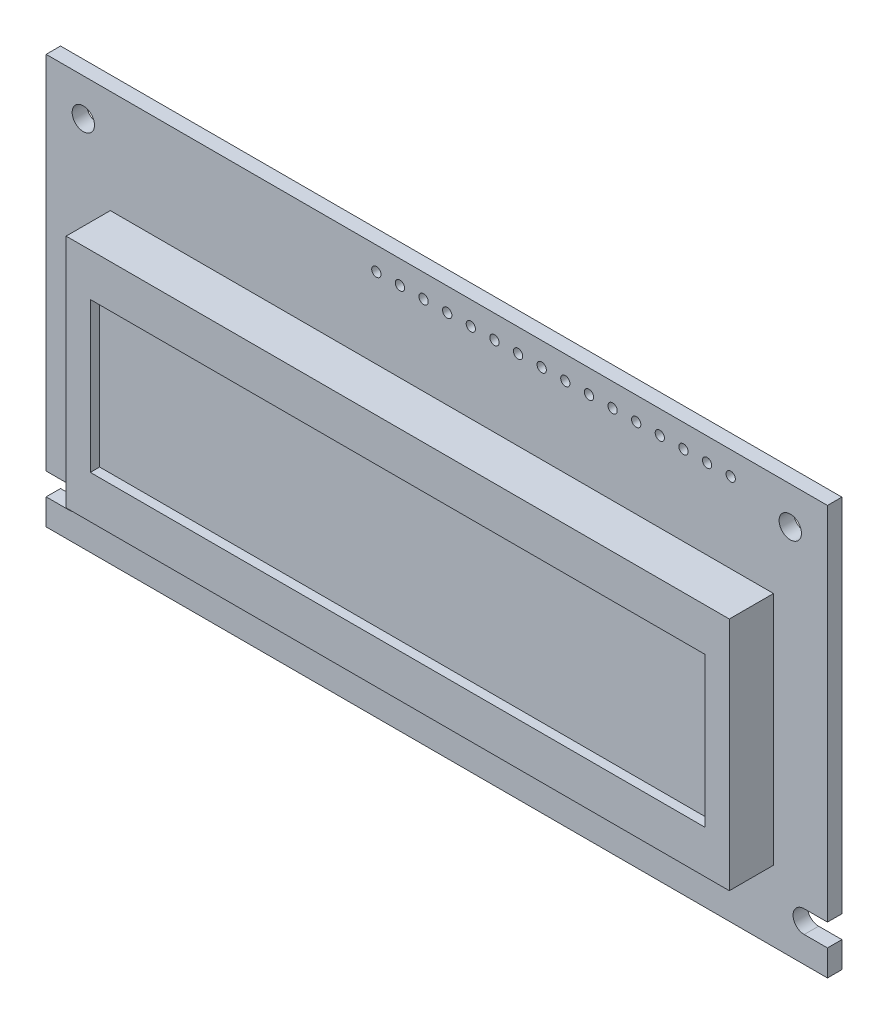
SolidWorks part; units mm, degrees
ref_plane "Plan de face" through (0, 0, 0) normal (0, 0, 1) x (1, 0, 0)
ref_plane "Plan de dessus" through (0, 0, 0) normal (0, 1, 0) x (1, 0, 0)
ref_plane "Plan de droite" through (0, 0, 0) normal (1, 0, 0) x (0, 0, -1)
sketch "Esquisse1" plane through (0, 0, 0) normal (0, 0, 1) x (1, 0, 0)
  line L0 (-56.4282, 29.4905) -> (26.4884, 29.4905) construction
  line L1 (-62.9008, 31.9905) -> (21.0992, 31.9905)
  line L2 (-62.9008, 31.9905) -> (-62.9008, -6.8095)
  line L3 (-62.9008, -12.0095) -> (21.0992, -12.0095)
  line L4 (21.0992, 31.9905) -> (21.0992, -6.8095)
  line L5 (-20.9008, 37.9919) -> (-20.9008, 31.9905) construction
  line L6 (-67.4282, 27.9905) -> (-57.0246, 27.9905) construction
  line L7 (-58.9008, 28.6835) -> (-58.9008, 9.2014) construction
  line L8 (-27.4008, 29.4905) -> (-27.4008, 41.6715) construction
  line L9 (-67.4282, -8.0095) -> (-56.4282, -8.0095) construction
  line L10 (-60.4008, -21.7605) -> (-60.4008, -4.1059) construction
  line L11 (-60.4008, -6.8095) -> (-62.9008, -6.8095)
  line L12 (-60.4008, -9.2095) -> (-62.9008, -9.2095)
  line L13 (-62.9008, -9.2095) -> (-62.9008, -12.0095)
  line L14 (18.5992, -9.2095) -> (21.0992, -9.2095)
  line L15 (18.5992, -6.8095) -> (21.0992, -6.8095)
  line L16 (21.0992, -9.2095) -> (21.0992, -12.0095)
  circle A0 centre (-58.9008, 27.9905) radius 1.2
  arc A1 (-60.4008, -9.2095) -> (-60.4008, -6.8095) centre (-60.4008, -8.0095) ccw
  arc A2 (18.5992, -9.2095) -> (18.5992, -6.8095) centre (18.5992, -8.0095) cw
  circle A3 centre (17.0992, 27.9905) radius 1.2
  circle A4 centre (-27.4008, 29.4905) radius 0.5
  circle A5 centre (-24.8608, 29.4905) radius 0.5
  circle A6 centre (-22.3208, 29.4905) radius 0.5
  circle A7 centre (-19.7808, 29.4905) radius 0.5
  circle A8 centre (-17.2408, 29.4905) radius 0.5
  circle A9 centre (-14.7008, 29.4905) radius 0.5
  circle A10 centre (-12.1608, 29.4905) radius 0.5
  circle A11 centre (-9.6208, 29.4905) radius 0.5
  circle A12 centre (-7.0808, 29.4905) radius 0.5
  circle A13 centre (-4.5408, 29.4905) radius 0.5
  circle A14 centre (-2.0008, 29.4905) radius 0.5
  circle A15 centre (0.5392, 29.4905) radius 0.5
  circle A16 centre (3.0792, 29.4905) radius 0.5
  circle A17 centre (5.6192, 29.4905) radius 0.5
  circle A18 centre (8.1592, 29.4905) radius 0.5
  circle A19 centre (10.6992, 29.4905) radius 0.5
  dimension "D5" = 4
  dimension "D6" = 16
  dimension "D7" = 35.5
  dimension "D8" = 4
  dimension "D1" = 84
  dimension "D2" = 44
  dimension "D3" = 4
  dimension "D4" = 2.5
  dimension "D9" = 2.5
extrude "Boss.-Extru.1" add sketch "Esquisse1" along normal blind 1.55
sketch "Esquisse2" plane through (0, 0, 1.55) normal (0, 0, 1) x (1, 0, 0)
  line L1 (-56.0008, 20.8905) -> (15.2992, 20.8905)
  line L2 (-56.0008, 20.8905) -> (-56.0008, -4.4095)
  line L3 (-56.0008, -4.4095) -> (15.2992, -4.4095)
  line L4 (15.2992, 20.8905) -> (15.2992, -4.4095)
  line L6 (21.0992, 31.9905) -> (-62.9008, 31.9905) construction
  line L7 (-62.9008, 31.9905) -> (-62.9008, -6.8095) construction
  dimension "D1" = 71.3
  dimension "D2" = 25.3
  dimension "D3" = 11.1
  dimension "D4" = 6.9
extrude "Boss.-Extru.2" add sketch "Esquisse2" along normal blind 4.75
sketch "Esquisse5" plane through (0, 0, 6.3) normal (0, 0, 1) x (1, 0, 0)
  line L1 (-56.0008, -4.4095) -> (15.2992, 20.8905) construction
  line L2 (-56.0008, 20.8905) -> (15.2992, -4.4095) construction
  line L3 (-56.0008, -4.4095) -> (15.2992, -4.4095) construction
  line L4 (-53.4008, 16.2905) -> (12.6992, 16.2905)
  line L6 (-53.4008, 16.2905) -> (-53.4008, 0.1905)
  line L7 (-53.4008, 0.1905) -> (12.6992, 0.1905)
  line L8 (12.6992, 16.2905) -> (12.6992, 0.1905)
  line L9 (-53.4008, 16.2905) -> (12.6992, 0.1905) construction
  line L10 (-53.4008, 0.1905) -> (12.6992, 16.2905) construction
  line L11 (-56.0008, 20.8905) -> (-56.0008, -4.4095) construction
  point P4 (-20.3508, 8.2405)
  dimension "D1" = 4.6
  dimension "D2" = 2.6
extrude "Enlèv. mat.-Extru.2" cut sketch "Esquisse5" against normal blind 1
